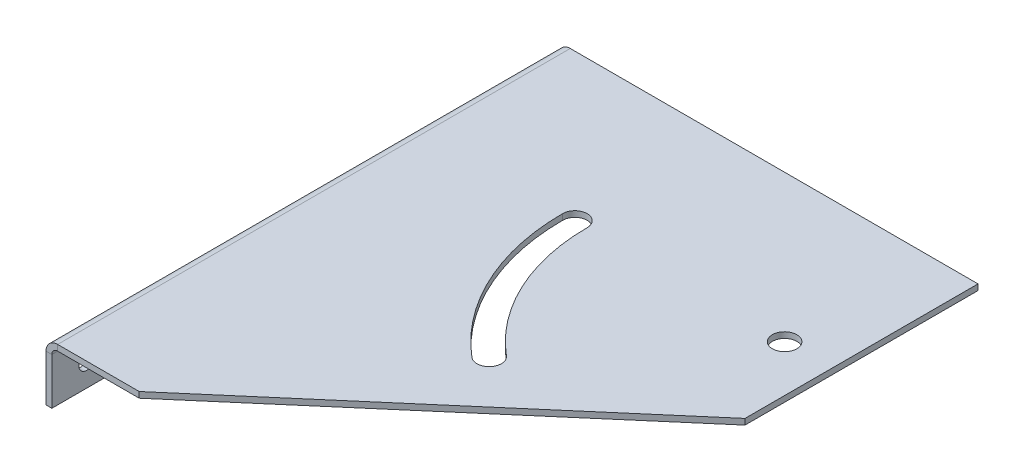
SolidWorks part; units mm, degrees
ref_plane "Plan de face" through (0, 0, 0) normal (0, 0, 1) x (1, 0, 0)
ref_plane "Plan de dessus" through (0, 0, 0) normal (0, 1, 0) x (1, 0, 0)
ref_plane "Plan de droite" through (0, 0, 0) normal (1, 0, 0) x (0, 0, -1)
mirrored part "RE040001_Rendre symétrique"
other "<RE040001>-<Dégagement M61>"
